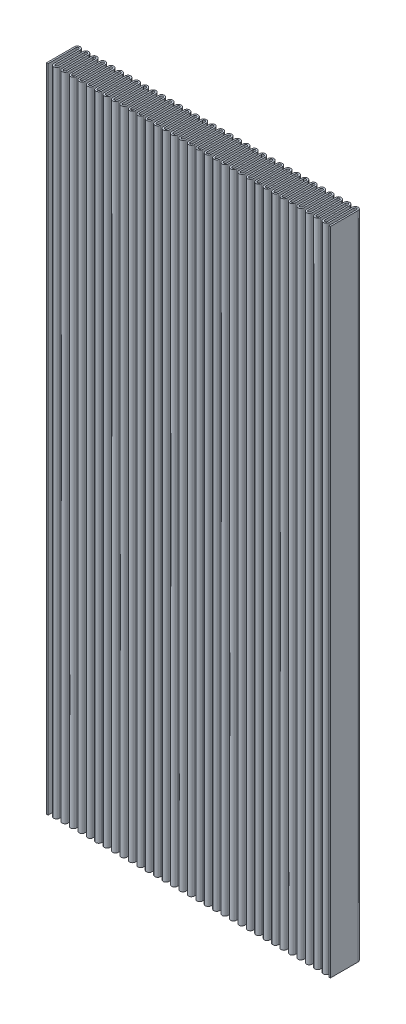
SolidWorks part; units mm, degrees
ref_plane "Front Plane" through (0, 0, 0) normal (0, 0, 1) x (1, 0, 0)
ref_plane "Top Plane" through (0, 0, 0) normal (0, 1, 0) x (1, 0, 0)
ref_plane "Right Plane" through (0, 0, 0) normal (1, 0, 0) x (0, 0, -1)
sketch "Sketch1" plane through (0, 0, 0) normal (0, 1, 0) x (1, 0, 0)
  line L8 (0, 0) -> (0, 4) construction
  line L9 (0, 4) -> (0.55, 4) construction
  line L10 (0.55, 4) -> (0.55, 0) construction
  line L11 (0.55, 0) -> (0, 0) construction
  line L12 (0.275, 4) -> (0.275, 3.88) construction
  line L13 (0.175, 3.625) -> (0.175, 0.375)
  line L14 (0.375, 3.625) -> (0.375, 0.375)
  line L15 (0.175, 3.79) -> (0.175, 0) construction
  line L16 (0.275, 3.79) -> (0.275, 0) construction
  line L17 (0.375, 3.79) -> (0.375, 0) construction
  line L18 (0, 4) -> (0, 3.8)
  line L19 (0.55, 0) -> (0.55, 0.2)
  line L20 (-0.175, 3.625) -> (-0.175, 0.375)
  line L21 (-0.375, 3.625) -> (-0.375, 0.375)
  line L22 (-0.175, 0.375) -> (-0.175, 0)
  line L23 (-0.175, 0) -> (-0.375, 0)
  line L24 (-0.375, 0) -> (-0.375, 0.375)
  line L25 (-0.375, 0) -> (36.675, 0) construction
  line L26 (0.925, 3.625) -> (0.925, 0.375)
  line L27 (0.725, 3.625) -> (0.725, 0.375)
  line L28 (1.1, 4) -> (1.1, 3.8) construction
  line L29 (1.275, 3.625) -> (1.275, 0.375)
  line L30 (1.475, 3.625) -> (1.475, 0.375)
  line L31 (1.825, 3.625) -> (1.825, 0.375)
  line L32 (2.025, 3.625) -> (2.025, 0.375)
  line L33 (2.375, 3.625) -> (2.375, 0.375)
  line L34 (2.575, 3.625) -> (2.575, 0.375)
  line L35 (2.925, 3.625) -> (2.925, 0.375)
  line L36 (3.125, 3.625) -> (3.125, 0.375)
  line L37 (3.475, 3.625) -> (3.475, 0.375)
  line L38 (3.675, 3.625) -> (3.675, 0.375)
  line L39 (4.025, 3.625) -> (4.025, 0.375)
  line L40 (4.225, 3.625) -> (4.225, 0.375)
  line L41 (4.575, 3.625) -> (4.575, 0.375)
  line L42 (4.775, 3.625) -> (4.775, 0.375)
  line L43 (5.125, 3.625) -> (5.125, 0.375)
  line L44 (5.325, 3.625) -> (5.325, 0.375)
  line L45 (5.675, 3.625) -> (5.675, 0.375)
  line L46 (5.875, 3.625) -> (5.875, 0.375)
  line L47 (6.225, 3.625) -> (6.225, 0.375)
  line L48 (6.425, 3.625) -> (6.425, 0.375)
  line L49 (6.775, 3.625) -> (6.775, 0.375)
  line L50 (6.975, 3.625) -> (6.975, 0.375)
  line L51 (7.325, 3.625) -> (7.325, 0.375)
  line L52 (7.525, 3.625) -> (7.525, 0.375)
  line L53 (7.875, 3.625) -> (7.875, 0.375)
  line L54 (8.075, 3.625) -> (8.075, 0.375)
  line L55 (8.425, 3.625) -> (8.425, 0.375)
  line L56 (8.625, 3.625) -> (8.625, 0.375)
  line L57 (8.975, 3.625) -> (8.975, 0.375)
  line L58 (9.175, 3.625) -> (9.175, 0.375)
  line L59 (9.525, 3.625) -> (9.525, 0.375)
  line L60 (9.725, 3.625) -> (9.725, 0.375)
  line L61 (10.075, 3.625) -> (10.075, 0.375)
  line L62 (10.275, 3.625) -> (10.275, 0.375)
  line L63 (10.625, 3.625) -> (10.625, 0.375)
  line L64 (10.825, 3.625) -> (10.825, 0.375)
  line L65 (11.175, 3.625) -> (11.175, 0.375)
  line L66 (11.375, 3.625) -> (11.375, 0.375)
  line L67 (11.725, 3.625) -> (11.725, 0.375)
  line L68 (11.925, 3.625) -> (11.925, 0.375)
  line L69 (12.275, 3.625) -> (12.275, 0.375)
  line L70 (12.475, 3.625) -> (12.475, 0.375)
  line L71 (12.825, 3.625) -> (12.825, 0.375)
  line L72 (13.025, 3.625) -> (13.025, 0.375)
  line L73 (13.375, 3.625) -> (13.375, 0.375)
  line L74 (13.575, 3.625) -> (13.575, 0.375)
  line L75 (13.925, 3.625) -> (13.925, 0.375)
  line L76 (14.125, 3.625) -> (14.125, 0.375)
  line L77 (14.475, 3.625) -> (14.475, 0.375)
  line L78 (14.675, 3.625) -> (14.675, 0.375)
  line L79 (15.025, 3.625) -> (15.025, 0.375)
  line L80 (15.225, 3.625) -> (15.225, 0.375)
  line L81 (15.575, 3.625) -> (15.575, 0.375)
  line L82 (15.775, 3.625) -> (15.775, 0.375)
  line L83 (16.125, 3.625) -> (16.125, 0.375)
  line L84 (16.325, 3.625) -> (16.325, 0.375)
  line L85 (16.675, 3.625) -> (16.675, 0.375)
  line L86 (16.875, 3.625) -> (16.875, 0.375)
  line L87 (17.225, 3.625) -> (17.225, 0.375)
  line L88 (17.425, 3.625) -> (17.425, 0.375)
  line L89 (17.775, 3.625) -> (17.775, 0.375)
  line L90 (17.975, 3.625) -> (17.975, 0.375)
  line L91 (18.325, 3.625) -> (18.325, 0.375)
  line L92 (18.525, 3.625) -> (18.525, 0.375)
  line L93 (18.875, 3.625) -> (18.875, 0.375)
  line L94 (19.075, 3.625) -> (19.075, 0.375)
  line L95 (19.425, 3.625) -> (19.425, 0.375)
  line L96 (19.625, 3.625) -> (19.625, 0.375)
  line L97 (19.975, 3.625) -> (19.975, 0.375)
  line L98 (20.175, 3.625) -> (20.175, 0.375)
  line L99 (20.525, 3.625) -> (20.525, 0.375)
  line L100 (20.725, 3.625) -> (20.725, 0.375)
  line L101 (21.075, 3.625) -> (21.075, 0.375)
  line L102 (21.275, 3.625) -> (21.275, 0.375)
  line L103 (21.625, 3.625) -> (21.625, 0.375)
  line L104 (21.825, 3.625) -> (21.825, 0.375)
  line L105 (22.175, 3.625) -> (22.175, 0.375)
  line L106 (22.375, 3.625) -> (22.375, 0.375)
  line L107 (22.725, 3.625) -> (22.725, 0.375)
  line L108 (22.925, 3.625) -> (22.925, 0.375)
  line L109 (23.275, 3.625) -> (23.275, 0.375)
  line L110 (23.475, 3.625) -> (23.475, 0.375)
  line L111 (23.825, 3.625) -> (23.825, 0.375)
  line L112 (24.025, 3.625) -> (24.025, 0.375)
  line L113 (24.375, 3.625) -> (24.375, 0.375)
  line L114 (24.575, 3.625) -> (24.575, 0.375)
  line L115 (24.925, 3.625) -> (24.925, 0.375)
  line L116 (25.125, 3.625) -> (25.125, 0.375)
  line L117 (25.475, 3.625) -> (25.475, 0.375)
  line L118 (25.675, 3.625) -> (25.675, 0.375)
  line L119 (26.025, 3.625) -> (26.025, 0.375)
  line L120 (26.225, 3.625) -> (26.225, 0.375)
  line L121 (26.575, 3.625) -> (26.575, 0.375)
  line L122 (26.775, 3.625) -> (26.775, 0.375)
  line L123 (27.125, 3.625) -> (27.125, 0.375)
  line L124 (27.325, 3.625) -> (27.325, 0.375)
  line L125 (27.675, 3.625) -> (27.675, 0.375)
  line L126 (27.875, 3.625) -> (27.875, 0.375)
  line L127 (28.225, 3.625) -> (28.225, 0.375)
  line L128 (28.425, 3.625) -> (28.425, 0.375)
  line L129 (28.775, 3.625) -> (28.775, 0.375)
  line L130 (28.975, 3.625) -> (28.975, 0.375)
  line L131 (29.325, 3.625) -> (29.325, 0.375)
  line L132 (29.525, 3.625) -> (29.525, 0.375)
  line L133 (29.875, 3.625) -> (29.875, 0.375)
  line L134 (30.075, 3.625) -> (30.075, 0.375)
  line L135 (30.425, 3.625) -> (30.425, 0.375)
  line L136 (30.625, 3.625) -> (30.625, 0.375)
  line L137 (30.975, 3.625) -> (30.975, 0.375)
  line L138 (31.175, 3.625) -> (31.175, 0.375)
  line L139 (31.525, 3.625) -> (31.525, 0.375)
  line L140 (31.725, 3.625) -> (31.725, 0.375)
  line L141 (32.075, 3.625) -> (32.075, 0.375)
  line L142 (32.275, 3.625) -> (32.275, 0.375)
  line L143 (32.625, 3.625) -> (32.625, 0.375)
  line L144 (32.825, 3.625) -> (32.825, 0.375)
  line L145 (33.175, 3.625) -> (33.175, 0.375)
  line L146 (33.375, 3.625) -> (33.375, 0.375)
  line L147 (33.725, 3.625) -> (33.725, 0.375)
  line L148 (33.925, 3.625) -> (33.925, 0.375)
  line L149 (34.275, 3.625) -> (34.275, 0.375)
  line L150 (34.475, 3.625) -> (34.475, 0.375)
  line L151 (34.825, 3.625) -> (34.825, 0.375)
  line L152 (35.025, 3.625) -> (35.025, 0.375)
  line L153 (35.375, 3.625) -> (35.375, 0.375)
  line L154 (35.575, 3.625) -> (35.575, 0.375)
  line L155 (35.925, 3.625) -> (35.925, 0.375)
  line L156 (36.125, 3.625) -> (36.125, 0.375)
  line L157 (36.475, 3.625) -> (36.475, 0)
  line L158 (36.475, 0) -> (36.675, 0)
  line L159 (36.675, 0) -> (36.675, 3.625)
  arc A3 (0.375, 3.625) -> (0, 4) centre (0, 3.625) ccw
  arc A4 (0.175, 3.625) -> (0, 3.8) centre (0, 3.625) ccw
  arc A5 (0.175, 0.375) -> (0.925, 0.375) centre (0.55, 0.375) ccw
  arc A6 (0.375, 0.375) -> (0.725, 0.375) centre (0.55, 0.375) ccw
  arc A7 (0.925, 3.625) -> (1.1, 3.8) centre (1.1, 3.625) cw
  arc A8 (0.725, 3.625) -> (1.1, 4) centre (1.1, 3.625) cw
  arc A9 (0, 3.8) -> (-0.175, 3.625) centre (0, 3.625) ccw
  arc A10 (0, 4) -> (-0.375, 3.625) centre (0, 3.625) ccw
  arc A11 (1.475, 3.625) -> (1.1, 4) centre (1.1, 3.625) ccw
  arc A12 (1.275, 3.625) -> (1.1, 3.8) centre (1.1, 3.625) ccw
  arc A13 (1.475, 0.375) -> (1.825, 0.375) centre (1.65, 0.375) ccw
  arc A14 (1.275, 0.375) -> (2.025, 0.375) centre (1.65, 0.375) ccw
  arc A15 (1.825, 3.625) -> (2.2, 4) centre (2.2, 3.625) cw
  arc A16 (2.025, 3.625) -> (2.2, 3.8) centre (2.2, 3.625) cw
  arc A17 (2.575, 3.625) -> (2.2, 4) centre (2.2, 3.625) ccw
  arc A18 (2.375, 3.625) -> (2.2, 3.8) centre (2.2, 3.625) ccw
  arc A19 (2.575, 0.375) -> (2.925, 0.375) centre (2.75, 0.375) ccw
  arc A20 (2.375, 0.375) -> (3.125, 0.375) centre (2.75, 0.375) ccw
  arc A21 (2.925, 3.625) -> (3.3, 4) centre (3.3, 3.625) cw
  arc A22 (3.125, 3.625) -> (3.3, 3.8) centre (3.3, 3.625) cw
  arc A23 (3.675, 3.625) -> (3.3, 4) centre (3.3, 3.625) ccw
  arc A24 (3.475, 3.625) -> (3.3, 3.8) centre (3.3, 3.625) ccw
  arc A25 (3.675, 0.375) -> (4.025, 0.375) centre (3.85, 0.375) ccw
  arc A26 (3.475, 0.375) -> (4.225, 0.375) centre (3.85, 0.375) ccw
  arc A27 (4.025, 3.625) -> (4.4, 4) centre (4.4, 3.625) cw
  arc A28 (4.225, 3.625) -> (4.4, 3.8) centre (4.4, 3.625) cw
  arc A29 (4.775, 3.625) -> (4.4, 4) centre (4.4, 3.625) ccw
  arc A30 (4.575, 3.625) -> (4.4, 3.8) centre (4.4, 3.625) ccw
  arc A31 (4.775, 0.375) -> (5.125, 0.375) centre (4.95, 0.375) ccw
  arc A32 (4.575, 0.375) -> (5.325, 0.375) centre (4.95, 0.375) ccw
  arc A33 (5.125, 3.625) -> (5.5, 4) centre (5.5, 3.625) cw
  arc A34 (5.325, 3.625) -> (5.5, 3.8) centre (5.5, 3.625) cw
  arc A35 (5.875, 3.625) -> (5.5, 4) centre (5.5, 3.625) ccw
  arc A36 (5.675, 3.625) -> (5.5, 3.8) centre (5.5, 3.625) ccw
  arc A37 (5.875, 0.375) -> (6.225, 0.375) centre (6.05, 0.375) ccw
  arc A38 (5.675, 0.375) -> (6.425, 0.375) centre (6.05, 0.375) ccw
  arc A39 (6.225, 3.625) -> (6.6, 4) centre (6.6, 3.625) cw
  arc A40 (6.425, 3.625) -> (6.6, 3.8) centre (6.6, 3.625) cw
  arc A41 (6.975, 3.625) -> (6.6, 4) centre (6.6, 3.625) ccw
  arc A42 (6.775, 3.625) -> (6.6, 3.8) centre (6.6, 3.625) ccw
  arc A43 (6.975, 0.375) -> (7.325, 0.375) centre (7.15, 0.375) ccw
  arc A44 (6.775, 0.375) -> (7.525, 0.375) centre (7.15, 0.375) ccw
  arc A45 (7.325, 3.625) -> (7.7, 4) centre (7.7, 3.625) cw
  arc A46 (7.525, 3.625) -> (7.7, 3.8) centre (7.7, 3.625) cw
  arc A47 (8.075, 3.625) -> (7.7, 4) centre (7.7, 3.625) ccw
  arc A48 (7.875, 3.625) -> (7.7, 3.8) centre (7.7, 3.625) ccw
  arc A49 (8.075, 0.375) -> (8.425, 0.375) centre (8.25, 0.375) ccw
  arc A50 (7.875, 0.375) -> (8.625, 0.375) centre (8.25, 0.375) ccw
  arc A51 (8.425, 3.625) -> (8.8, 4) centre (8.8, 3.625) cw
  arc A52 (8.625, 3.625) -> (8.8, 3.8) centre (8.8, 3.625) cw
  arc A53 (9.175, 3.625) -> (8.8, 4) centre (8.8, 3.625) ccw
  arc A54 (8.975, 3.625) -> (8.8, 3.8) centre (8.8, 3.625) ccw
  arc A55 (9.175, 0.375) -> (9.525, 0.375) centre (9.35, 0.375) ccw
  arc A56 (8.975, 0.375) -> (9.725, 0.375) centre (9.35, 0.375) ccw
  arc A57 (9.525, 3.625) -> (9.9, 4) centre (9.9, 3.625) cw
  arc A58 (9.725, 3.625) -> (9.9, 3.8) centre (9.9, 3.625) cw
  arc A59 (10.275, 3.625) -> (9.9, 4) centre (9.9, 3.625) ccw
  arc A60 (10.075, 3.625) -> (9.9, 3.8) centre (9.9, 3.625) ccw
  arc A61 (10.275, 0.375) -> (10.625, 0.375) centre (10.45, 0.375) ccw
  arc A62 (10.075, 0.375) -> (10.825, 0.375) centre (10.45, 0.375) ccw
  arc A63 (10.625, 3.625) -> (11, 4) centre (11, 3.625) cw
  arc A64 (10.825, 3.625) -> (11, 3.8) centre (11, 3.625) cw
  arc A65 (11.375, 3.625) -> (11, 4) centre (11, 3.625) ccw
  arc A66 (11.175, 3.625) -> (11, 3.8) centre (11, 3.625) ccw
  arc A67 (11.375, 0.375) -> (11.725, 0.375) centre (11.55, 0.375) ccw
  arc A68 (11.175, 0.375) -> (11.925, 0.375) centre (11.55, 0.375) ccw
  arc A69 (11.725, 3.625) -> (12.1, 4) centre (12.1, 3.625) cw
  arc A70 (11.925, 3.625) -> (12.1, 3.8) centre (12.1, 3.625) cw
  arc A71 (12.475, 3.625) -> (12.1, 4) centre (12.1, 3.625) ccw
  arc A72 (12.275, 3.625) -> (12.1, 3.8) centre (12.1, 3.625) ccw
  arc A73 (12.475, 0.375) -> (12.825, 0.375) centre (12.65, 0.375) ccw
  arc A74 (12.275, 0.375) -> (13.025, 0.375) centre (12.65, 0.375) ccw
  arc A75 (12.825, 3.625) -> (13.2, 4) centre (13.2, 3.625) cw
  arc A76 (13.025, 3.625) -> (13.2, 3.8) centre (13.2, 3.625) cw
  arc A77 (13.575, 3.625) -> (13.2, 4) centre (13.2, 3.625) ccw
  arc A78 (13.375, 3.625) -> (13.2, 3.8) centre (13.2, 3.625) ccw
  arc A79 (13.575, 0.375) -> (13.925, 0.375) centre (13.75, 0.375) ccw
  arc A80 (13.375, 0.375) -> (14.125, 0.375) centre (13.75, 0.375) ccw
  arc A81 (13.925, 3.625) -> (14.3, 4) centre (14.3, 3.625) cw
  arc A82 (14.125, 3.625) -> (14.3, 3.8) centre (14.3, 3.625) cw
  arc A83 (14.675, 3.625) -> (14.3, 4) centre (14.3, 3.625) ccw
  arc A84 (14.475, 3.625) -> (14.3, 3.8) centre (14.3, 3.625) ccw
  arc A85 (14.675, 0.375) -> (15.025, 0.375) centre (14.85, 0.375) ccw
  arc A86 (14.475, 0.375) -> (15.225, 0.375) centre (14.85, 0.375) ccw
  arc A87 (15.025, 3.625) -> (15.4, 4) centre (15.4, 3.625) cw
  arc A88 (15.225, 3.625) -> (15.4, 3.8) centre (15.4, 3.625) cw
  arc A89 (15.775, 3.625) -> (15.4, 4) centre (15.4, 3.625) ccw
  arc A90 (15.575, 3.625) -> (15.4, 3.8) centre (15.4, 3.625) ccw
  arc A91 (15.775, 0.375) -> (16.125, 0.375) centre (15.95, 0.375) ccw
  arc A92 (15.575, 0.375) -> (16.325, 0.375) centre (15.95, 0.375) ccw
  arc A93 (16.125, 3.625) -> (16.5, 4) centre (16.5, 3.625) cw
  arc A94 (16.325, 3.625) -> (16.5, 3.8) centre (16.5, 3.625) cw
  arc A95 (16.875, 3.625) -> (16.5, 4) centre (16.5, 3.625) ccw
  arc A96 (16.675, 3.625) -> (16.5, 3.8) centre (16.5, 3.625) ccw
  arc A97 (16.875, 0.375) -> (17.225, 0.375) centre (17.05, 0.375) ccw
  arc A98 (16.675, 0.375) -> (17.425, 0.375) centre (17.05, 0.375) ccw
  arc A99 (17.225, 3.625) -> (17.6, 4) centre (17.6, 3.625) cw
  arc A100 (17.425, 3.625) -> (17.6, 3.8) centre (17.6, 3.625) cw
  arc A101 (17.975, 3.625) -> (17.6, 4) centre (17.6, 3.625) ccw
  arc A102 (17.775, 3.625) -> (17.6, 3.8) centre (17.6, 3.625) ccw
  arc A103 (17.975, 0.375) -> (18.325, 0.375) centre (18.15, 0.375) ccw
  arc A104 (17.775, 0.375) -> (18.525, 0.375) centre (18.15, 0.375) ccw
  arc A105 (18.325, 3.625) -> (18.7, 4) centre (18.7, 3.625) cw
  arc A106 (18.525, 3.625) -> (18.7, 3.8) centre (18.7, 3.625) cw
  arc A107 (19.075, 3.625) -> (18.7, 4) centre (18.7, 3.625) ccw
  arc A108 (18.875, 3.625) -> (18.7, 3.8) centre (18.7, 3.625) ccw
  arc A109 (19.075, 0.375) -> (19.425, 0.375) centre (19.25, 0.375) ccw
  arc A110 (18.875, 0.375) -> (19.625, 0.375) centre (19.25, 0.375) ccw
  arc A111 (19.425, 3.625) -> (19.8, 4) centre (19.8, 3.625) cw
  arc A112 (19.625, 3.625) -> (19.8, 3.8) centre (19.8, 3.625) cw
  arc A113 (20.175, 3.625) -> (19.8, 4) centre (19.8, 3.625) ccw
  arc A114 (19.975, 3.625) -> (19.8, 3.8) centre (19.8, 3.625) ccw
  arc A115 (20.175, 0.375) -> (20.525, 0.375) centre (20.35, 0.375) ccw
  arc A116 (19.975, 0.375) -> (20.725, 0.375) centre (20.35, 0.375) ccw
  arc A117 (20.525, 3.625) -> (20.9, 4) centre (20.9, 3.625) cw
  arc A118 (20.725, 3.625) -> (20.9, 3.8) centre (20.9, 3.625) cw
  arc A119 (21.275, 3.625) -> (20.9, 4) centre (20.9, 3.625) ccw
  arc A120 (21.075, 3.625) -> (20.9, 3.8) centre (20.9, 3.625) ccw
  arc A121 (21.275, 0.375) -> (21.625, 0.375) centre (21.45, 0.375) ccw
  arc A122 (21.075, 0.375) -> (21.825, 0.375) centre (21.45, 0.375) ccw
  arc A123 (21.625, 3.625) -> (22, 4) centre (22, 3.625) cw
  arc A124 (21.825, 3.625) -> (22, 3.8) centre (22, 3.625) cw
  arc A125 (22.375, 3.625) -> (22, 4) centre (22, 3.625) ccw
  arc A126 (22.175, 3.625) -> (22, 3.8) centre (22, 3.625) ccw
  arc A127 (22.375, 0.375) -> (22.725, 0.375) centre (22.55, 0.375) ccw
  arc A128 (22.175, 0.375) -> (22.925, 0.375) centre (22.55, 0.375) ccw
  arc A129 (22.725, 3.625) -> (23.1, 4) centre (23.1, 3.625) cw
  arc A130 (22.925, 3.625) -> (23.1, 3.8) centre (23.1, 3.625) cw
  arc A131 (23.475, 3.625) -> (23.1, 4) centre (23.1, 3.625) ccw
  arc A132 (23.275, 3.625) -> (23.1, 3.8) centre (23.1, 3.625) ccw
  arc A133 (23.475, 0.375) -> (23.825, 0.375) centre (23.65, 0.375) ccw
  arc A134 (23.275, 0.375) -> (24.025, 0.375) centre (23.65, 0.375) ccw
  arc A135 (23.825, 3.625) -> (24.2, 4) centre (24.2, 3.625) cw
  arc A136 (24.025, 3.625) -> (24.2, 3.8) centre (24.2, 3.625) cw
  arc A137 (24.575, 3.625) -> (24.2, 4) centre (24.2, 3.625) ccw
  arc A138 (24.375, 3.625) -> (24.2, 3.8) centre (24.2, 3.625) ccw
  arc A139 (24.575, 0.375) -> (24.925, 0.375) centre (24.75, 0.375) ccw
  arc A140 (24.375, 0.375) -> (25.125, 0.375) centre (24.75, 0.375) ccw
  arc A141 (24.925, 3.625) -> (25.3, 4) centre (25.3, 3.625) cw
  arc A142 (25.125, 3.625) -> (25.3, 3.8) centre (25.3, 3.625) cw
  arc A143 (25.675, 3.625) -> (25.3, 4) centre (25.3, 3.625) ccw
  arc A144 (25.475, 3.625) -> (25.3, 3.8) centre (25.3, 3.625) ccw
  arc A145 (25.675, 0.375) -> (26.025, 0.375) centre (25.85, 0.375) ccw
  arc A146 (25.475, 0.375) -> (26.225, 0.375) centre (25.85, 0.375) ccw
  arc A147 (26.025, 3.625) -> (26.4, 4) centre (26.4, 3.625) cw
  arc A148 (26.225, 3.625) -> (26.4, 3.8) centre (26.4, 3.625) cw
  arc A149 (26.775, 3.625) -> (26.4, 4) centre (26.4, 3.625) ccw
  arc A150 (26.575, 3.625) -> (26.4, 3.8) centre (26.4, 3.625) ccw
  arc A151 (26.775, 0.375) -> (27.125, 0.375) centre (26.95, 0.375) ccw
  arc A152 (26.575, 0.375) -> (27.325, 0.375) centre (26.95, 0.375) ccw
  arc A153 (27.125, 3.625) -> (27.5, 4) centre (27.5, 3.625) cw
  arc A154 (27.325, 3.625) -> (27.5, 3.8) centre (27.5, 3.625) cw
  arc A155 (27.875, 3.625) -> (27.5, 4) centre (27.5, 3.625) ccw
  arc A156 (27.675, 3.625) -> (27.5, 3.8) centre (27.5, 3.625) ccw
  arc A157 (27.875, 0.375) -> (28.225, 0.375) centre (28.05, 0.375) ccw
  arc A158 (27.675, 0.375) -> (28.425, 0.375) centre (28.05, 0.375) ccw
  arc A159 (28.225, 3.625) -> (28.6, 4) centre (28.6, 3.625) cw
  arc A160 (28.425, 3.625) -> (28.6, 3.8) centre (28.6, 3.625) cw
  arc A161 (28.975, 3.625) -> (28.6, 4) centre (28.6, 3.625) ccw
  arc A162 (28.775, 3.625) -> (28.6, 3.8) centre (28.6, 3.625) ccw
  arc A163 (28.975, 0.375) -> (29.325, 0.375) centre (29.15, 0.375) ccw
  arc A164 (28.775, 0.375) -> (29.525, 0.375) centre (29.15, 0.375) ccw
  arc A165 (29.325, 3.625) -> (29.7, 4) centre (29.7, 3.625) cw
  arc A166 (29.525, 3.625) -> (29.7, 3.8) centre (29.7, 3.625) cw
  arc A167 (30.075, 3.625) -> (29.7, 4) centre (29.7, 3.625) ccw
  arc A168 (29.875, 3.625) -> (29.7, 3.8) centre (29.7, 3.625) ccw
  arc A169 (30.075, 0.375) -> (30.425, 0.375) centre (30.25, 0.375) ccw
  arc A170 (29.875, 0.375) -> (30.625, 0.375) centre (30.25, 0.375) ccw
  arc A171 (30.425, 3.625) -> (30.8, 4) centre (30.8, 3.625) cw
  arc A172 (30.625, 3.625) -> (30.8, 3.8) centre (30.8, 3.625) cw
  arc A173 (31.175, 3.625) -> (30.8, 4) centre (30.8, 3.625) ccw
  arc A174 (30.975, 3.625) -> (30.8, 3.8) centre (30.8, 3.625) ccw
  arc A175 (31.175, 0.375) -> (31.525, 0.375) centre (31.35, 0.375) ccw
  arc A176 (30.975, 0.375) -> (31.725, 0.375) centre (31.35, 0.375) ccw
  arc A177 (31.525, 3.625) -> (31.9, 4) centre (31.9, 3.625) cw
  arc A178 (31.725, 3.625) -> (31.9, 3.8) centre (31.9, 3.625) cw
  arc A179 (32.275, 3.625) -> (31.9, 4) centre (31.9, 3.625) ccw
  arc A180 (32.075, 3.625) -> (31.9, 3.8) centre (31.9, 3.625) ccw
  arc A181 (32.275, 0.375) -> (32.625, 0.375) centre (32.45, 0.375) ccw
  arc A182 (32.075, 0.375) -> (32.825, 0.375) centre (32.45, 0.375) ccw
  arc A183 (32.625, 3.625) -> (33, 4) centre (33, 3.625) cw
  arc A184 (32.825, 3.625) -> (33, 3.8) centre (33, 3.625) cw
  arc A185 (33.375, 3.625) -> (33, 4) centre (33, 3.625) ccw
  arc A186 (33.175, 3.625) -> (33, 3.8) centre (33, 3.625) ccw
  arc A187 (33.375, 0.375) -> (33.725, 0.375) centre (33.55, 0.375) ccw
  arc A188 (33.175, 0.375) -> (33.925, 0.375) centre (33.55, 0.375) ccw
  arc A189 (33.725, 3.625) -> (34.1, 4) centre (34.1, 3.625) cw
  arc A190 (33.925, 3.625) -> (34.1, 3.8) centre (34.1, 3.625) cw
  arc A191 (34.475, 3.625) -> (34.1, 4) centre (34.1, 3.625) ccw
  arc A192 (34.275, 3.625) -> (34.1, 3.8) centre (34.1, 3.625) ccw
  arc A193 (34.475, 0.375) -> (34.825, 0.375) centre (34.65, 0.375) ccw
  arc A194 (34.275, 0.375) -> (35.025, 0.375) centre (34.65, 0.375) ccw
  arc A195 (34.825, 3.625) -> (35.2, 4) centre (35.2, 3.625) cw
  arc A196 (35.025, 3.625) -> (35.2, 3.8) centre (35.2, 3.625) cw
  arc A197 (35.575, 3.625) -> (35.2, 4) centre (35.2, 3.625) ccw
  arc A198 (35.375, 3.625) -> (35.2, 3.8) centre (35.2, 3.625) ccw
  arc A199 (35.575, 0.375) -> (35.925, 0.375) centre (35.75, 0.375) ccw
  arc A200 (35.375, 0.375) -> (36.125, 0.375) centre (35.75, 0.375) ccw
  arc A201 (35.925, 3.625) -> (36.3, 4) centre (36.3, 3.625) cw
  arc A202 (36.125, 3.625) -> (36.3, 3.8) centre (36.3, 3.625) cw
  arc A203 (36.3, 3.8) -> (36.475, 3.625) centre (36.3, 3.625) cw
  arc A204 (36.3, 4) -> (36.675, 3.625) centre (36.3, 3.625) cw
  dimension "D5" = 0.375
  dimension "D6" = 0.175
  dimension "D7" = 0.175
  dimension "D1" = 0.2
  dimension "D2" = 4
  dimension "D3" = 0.1
  dimension "D4" = 0.1
  dimension "D8" = 33
  dimension "D9" = 37.05
  dimension "D11" = 0.2
extrude "Boss-Extrude1" add sketch "Sketch1" along normal blind 85 contours A204 A201 L155 A199 L154 A197 A195 L151 A193 L150 A191 A189 L147 A187 L146 A185 A183 L143 A181 L142 A179 A177 L139 A175 L138 A173 A171 L135 A169 L134 A167 A165 L131 A163 L130 A161 A159 L127 A157 L126 A155 A153 L123 A151 L122 A149 A147 L119 A145 L118 A143 | A6 L14 A3 L18 A4 L13 A5 L19 | L18 A10 L21 L24 L23 L22 L20 A9
